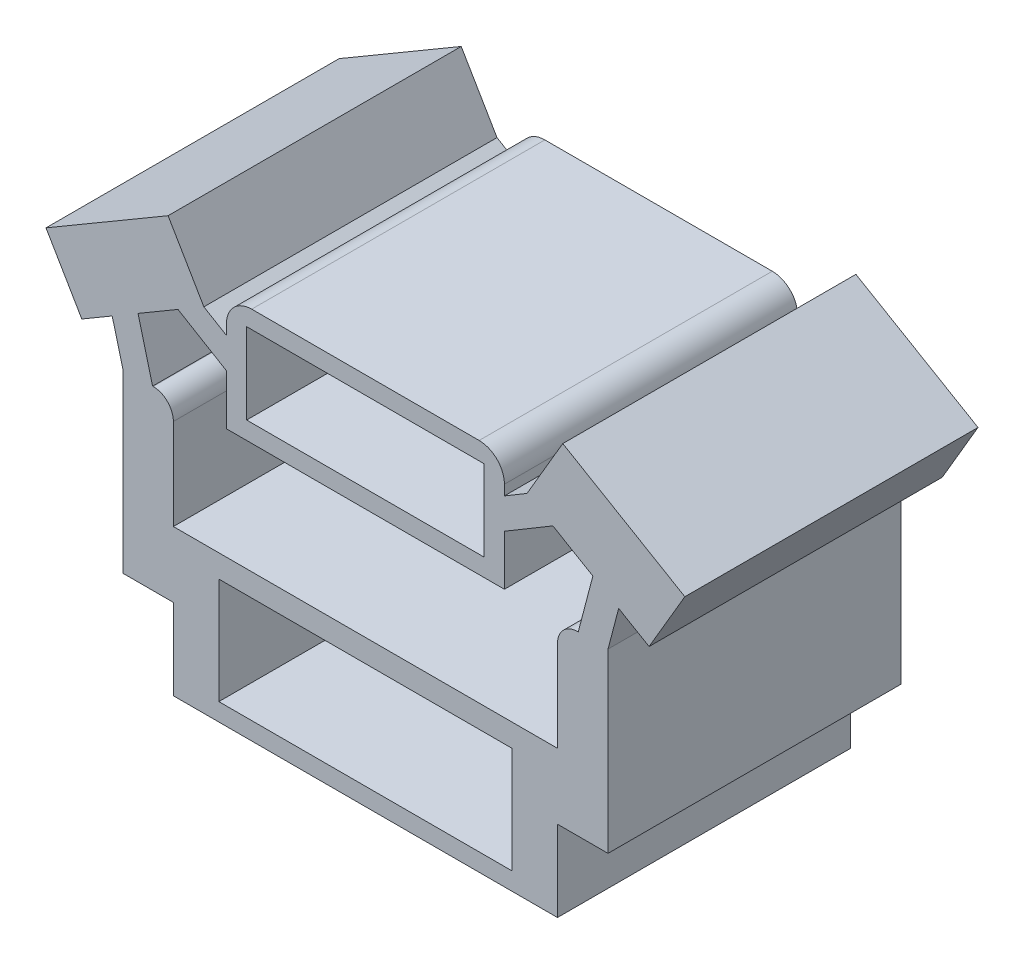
SolidWorks part; units mm, degrees
ref_plane "前视基准面" through (0, 0, 0) normal (0, 0, 1) x (1, 0, 0)
ref_plane "上视基准面" through (0, 0, 0) normal (0, 1, 0) x (1, 0, 0)
ref_plane "右视基准面" through (0, 0, 0) normal (1, 0, 0) x (0, 0, -1)
other "Configuration Table"
sketch "草图1" plane through (0, 0, 0) normal (0, 0, 1) x (1, 0, 0)
  line L0 (2.75, 5.2) -> (3.1967, 5.4663)
  line L1 (-3.8, -1.4) -> (3.8, -1.4)
  line L2 (-3.8, -1.4) -> (-3.8, 1.4)
  line L4 (3.8, -1.4) -> (3.8, 0.1)
  line L5 (-3.8, -1.4) -> (3.8, 1.4) construction
  line L6 (-3.8, 1.4) -> (3.8, -1.4) construction
  line L7 (-2.75, 5.2) -> (2.75, 5.2)
  line L8 (-2.75, 5.2) -> (-2.75, 3.6)
  line L9 (-2.75, 3.6) -> (2.75, 3.6)
  line L10 (2.75, 4.5946) -> (2.75, 3.6)
  line L11 (-2.75, 5.2) -> (2.75, 3.6) construction
  line L12 (-2.75, 3.6) -> (2.75, 5.2) construction
  line L14 (3.8, 0.1) -> (4.8, 0.1)
  line L17 (3.9047, 6.674) -> (3.1967, 5.4663)
  line L19 (3.9047, 6.674) -> (6.3202, 5.2579)
  line L33 (2.75, 5.2) -> (2.75, 4.5946) construction
  line L34 (3.1967, 5.4663) -> (3.7087, 5.1661) construction
  line L37 (4.8, 3.6) -> (4.8, 0.1)
  line L38 (-3.8, 1.4) -> (3.8, 1.4)
  line L39 (3.8, 1.4) -> (3.8, 0.1) construction
  line L40 (0, 9.062) -> (0, -4.0269) construction
  line L41 (2.75, 4.5946) -> (3.7087, 5.1661)
  line L48 (3.7087, 5.1661) -> (4.4999, 4.7023)
  line L51 (4.2107, 3.6) -> (4.4999, 4.7023)
  line L53 (5.0106, 4.4028) -> (5.6122, 4.0502)
  line L55 (4.4999, 4.7023) -> (5.0106, 4.4028) construction
  line L56 (4.2107, 3.6) -> (4.8, 3.6) construction
  line L57 (3.8, 1.4) -> (3.8, 3.6)
  line L58 (3.8, 3.6) -> (4.2107, 3.6)
  line L59 (4.8, 3.6) -> (5.0106, 4.4028)
  line L60 (5.6122, 4.0502) -> (6.3202, 5.2579)
  point P0 (0, 0)
  point P6 (0, 4.4)
  dimension "D1" = 7.6
  dimension "D2" = 2.8
  dimension "D3" = 5.5
  dimension "D4" = 1.6
  dimension "D5" = 1
  dimension "D6" = 75.3
  dimension "D7" = 0.52
  dimension "D8" = 0.52
  dimension "D9" = 3.5
  dimension "D10" = 1.4
  dimension "D11" = 0.57
  dimension "D12" = 2.2
  dimension "D13" = 0.83
  dimension "D14" = 2.2
  dimension "D15" = 2.8
  dimension "D16" = 120.8
extrude "凸台-拉伸1" add sketch "草图1" along normal blind 5.8
mirror "镜向1" about plane through (0, 0, 0) normal (1, 0, 0) of "凸台-拉伸1"
sketch "草图10" plane through (0, 0, 5.8) normal (0, 0, 1) x (1, 0, 0)
  line L0 (-2.75, 3.6) -> (2.75, 3.6) construction
  line L1 (-2.9, -1.05) -> (2.9, -1.05)
  line L2 (-2.9, -1.05) -> (-2.9, 1.05)
  line L3 (-2.9, 1.05) -> (2.9, 1.05)
  line L4 (2.9, -1.05) -> (2.9, 1.05)
  line L5 (-2.9, -1.05) -> (2.9, 1.05) construction
  line L6 (-2.9, 1.05) -> (2.9, -1.05) construction
  line L7 (-2.35, 5.55) -> (2.35, 5.55)
  line L8 (-2.35, 5.55) -> (-2.35, 3.95)
  line L9 (-2.35, 3.95) -> (2.35, 3.95)
  line L10 (2.35, 5.55) -> (2.35, 3.95)
  point P0 (0, 0)
  point P10 (0, 5.55)
  dimension "D1" = 5.8
  dimension "D2" = 2.1
  dimension "D3" = 4.7
  dimension "D4" = 1.6
  dimension "D5" = 0.35
extrude "切除-拉伸3" cut sketch "草图10" against normal through all
sketch "草图11" plane through (0, 0, 5.8) normal (0, 0, 1) x (1, 0, 0)
  line L0 (-2.35, 5.2) -> (-2.75, 5.2)
  line L1 (-2.75, 5.2) -> (-2.75, 5.9)
  line L2 (-2.75, 5.9) -> (2.75, 5.9)
  line L3 (2.75, 5.9) -> (2.75, 5.2)
  line L4 (2.75, 3.6) -> (2.75, 4.5946) construction
  line L5 (2.75, 5.2) -> (2.35, 5.2)
  line L6 (2.35, 5.2) -> (2.35, 5.55)
  line L7 (2.35, 5.55) -> (-2.35, 5.55)
  line L8 (-2.35, 5.55) -> (-2.35, 5.2)
  line L9 (-2.35, 3.95) -> (2.35, 3.95) construction
  dimension "D1" = 0.35
  dimension "D2" = 1.6
extrude "凸台-拉伸2" add sketch "草图11" against normal up to surface (5.8 mm away)
fillet "圆角1" radius 0.5 2 edges at (-2.75, 5.9, 2.9) (2.75, 5.9, 2.9)
sketch "草图12" plane through (0, 0, 5.8) normal (0, 0, 1) x (1, 0, 0)
  line L0 (-2.9, 1.05) -> (-2.9, -1.05) construction
  line L1 (-2.9, 0.95) -> (2.9, 0.95)
  line L2 (-2.9, 0.95) -> (-2.9, 1.05)
  line L3 (-2.9, 1.05) -> (2.9, 1.05)
  line L4 (2.9, 0.95) -> (2.9, 1.05)
  line L5 (3.8, -1.4) -> (3.8, 0.1) construction
  line L6 (-3.8, -1.4) -> (3.8, -1.4)
  line L7 (-3.8, -1.4) -> (-3.8, -1.5)
  line L8 (-3.8, -1.5) -> (3.8, -1.5)
  line L9 (3.8, -1.4) -> (3.8, -1.5)
  dimension "D1" = 0.1
  dimension "D2" = 0.1
extrude "凸台-拉伸3" add sketch "草图12" against normal up to surface (5.8 mm away)
sketch "草图14" plane through (0, 0, 5.8) normal (0, 0, 1) x (1, 0, 0)
  line L0 (2.9, -1.05) -> (2.9, 0.95) construction
  line L1 (-2.9, -1.05) -> (2.9, -1.05)
  line L2 (-2.9, -1.05) -> (-2.9, -1.15)
  line L3 (-2.9, -1.15) -> (2.9, -1.15)
  line L4 (2.9, -1.05) -> (2.9, -1.15)
  dimension "D1" = 0.1
extrude "切除-拉伸4" cut sketch "草图14" against normal through all
sketch "草图15" plane through (0, 0, 5.8) normal (0, 0, 1) x (1, 0, 0)
  line L0 (0, 5.2) -> (0, 1.4)
  line L2 (3.8, 1.4) -> (-3.8, 1.4) construction
  line L3 (0, 1.4) -> (3.8, 1.4)
  line L4 (3.8, 1.4) -> (3.8, 3.6)
  line L5 (3.8, 3.6) -> (4.8, 3.6)
  line L6 (4.8, 3.6) -> (5.0106, 4.4028)
  line L7 (5.0106, 4.4028) -> (3.1967, 5.4663)
  line L8 (3.1967, 5.4663) -> (2.75, 5.2)
  line L9 (2.75, 5.2) -> (0, 5.2)
sketch "草图16" plane through (0, 0, 5.8) normal (0, 0, 1) x (1, 0, 0)
  line L0 (-2.35, 5.55) -> (-2.35, 3.95) construction
  line L1 (-2.35, 4.05) -> (2.35, 4.05)
  line L2 (-2.35, 4.05) -> (-2.35, 3.95)
  line L3 (-2.35, 3.95) -> (2.35, 3.95)
  line L4 (2.35, 4.05) -> (2.35, 3.95)
  dimension "D1" = 0.1
extrude "凸台-拉伸4" [suppressed] add sketch "草图16" against normal up to surface (5.8 mm away)
fillet "圆角2" radius 0.4 2 edges at (-3.8, 3.6, 2.9) (3.8, 3.6, 2.9)
sketch "草图17" plane through (0, 0, 5.8) normal (0, 0, 1) x (1, 0, 0)
  line L0 (-2.9, 2.0221) -> (-2.9, -1.8376)
  line L1 (-2.35, 6.4076) -> (-2.35, 2.8612)
